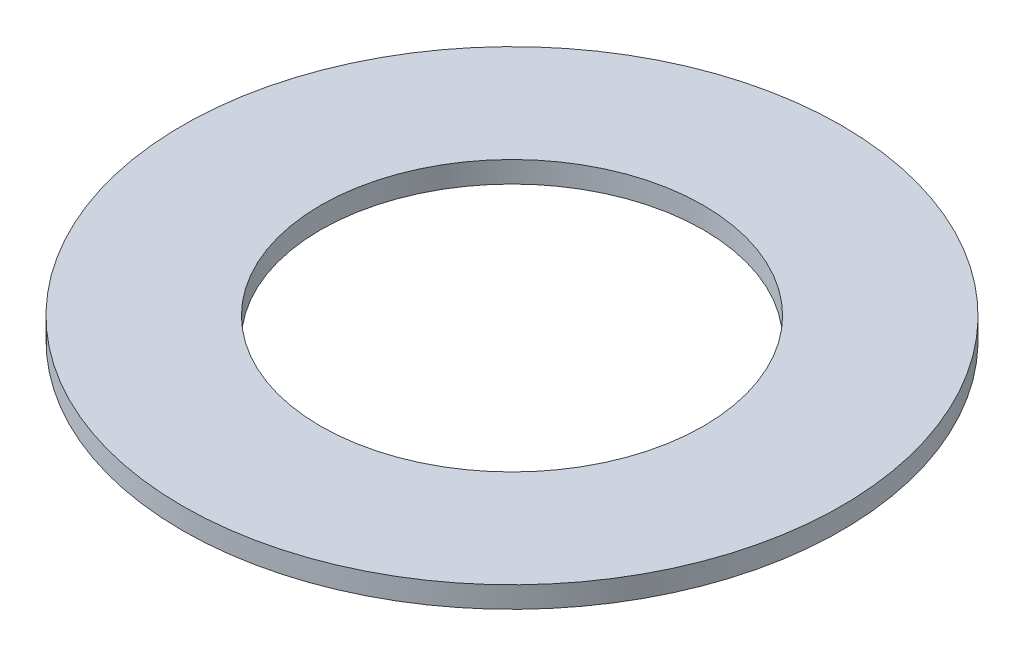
SolidWorks part; units mm, degrees
ref_plane "Front Plane" through (0, 0, 0) normal (0, 0, 1) x (1, 0, 0)
ref_plane "Top Plane" through (0, 0, 0) normal (0, 1, 0) x (1, 0, 0)
ref_plane "Right Plane" through (0, 0, 0) normal (1, 0, 0) x (0, 0, -1)
sketch "Sketch1" plane through (0, 0, 0) normal (1, 0, 0) x (0, 0, -1)
  line L0 (0, 14.8699) -> (0, -9.2052) construction
  line L2 (3.937, -0.127) -> (2.286, -0.127)
  line L3 (3.937, -0.127) -> (3.937, 0.127)
  line L4 (3.937, 0.127) -> (2.286, 0.127)
  line L5 (2.286, -0.127) -> (2.286, 0.127)
  line L6 (3.937, -0.127) -> (2.286, 0.127) construction
  line L7 (3.937, 0.127) -> (2.286, -0.127) construction
  point P3 (3.1115, 0)
  dimension "D1" = 7.874
  dimension "D2" = 4.572
  dimension "D3" = 0.254
revolve "Revolve1" add sketch "Sketch1" angle 360 about L0
